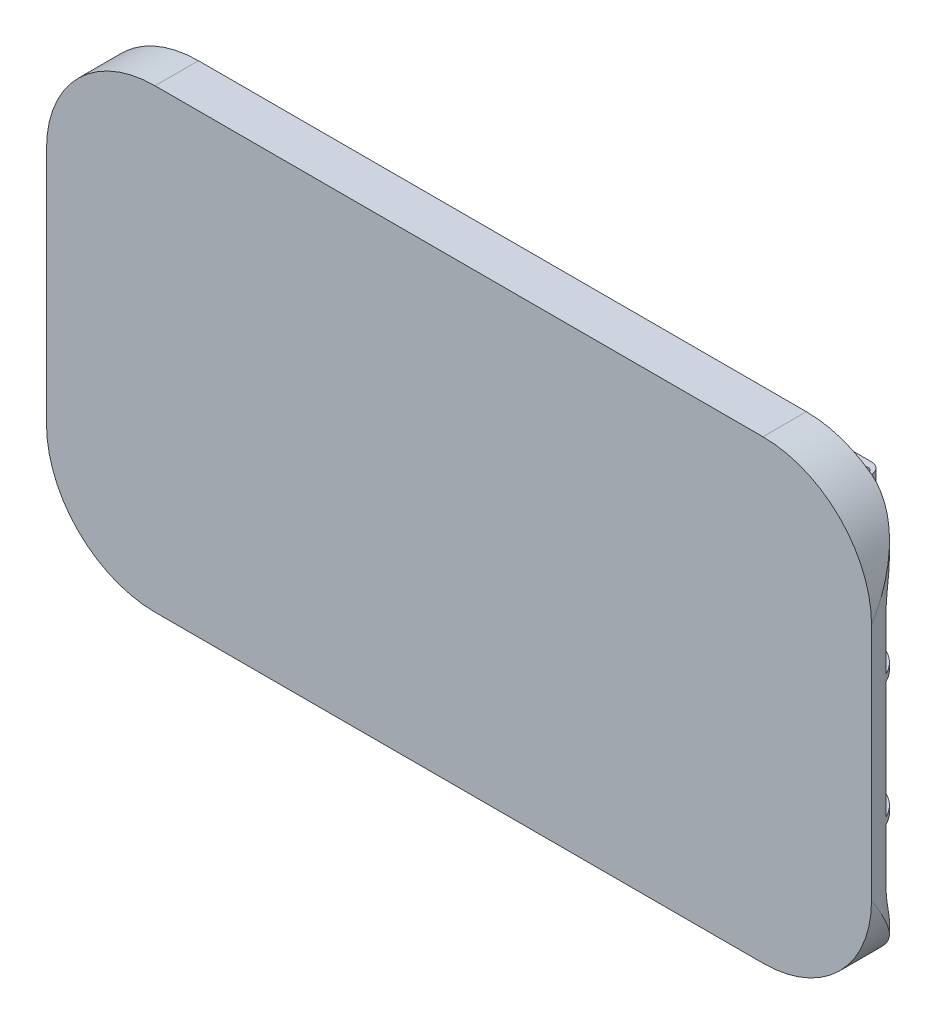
SolidWorks part; units mm, degrees
ref_plane "Front Plane" through (0, 0, 0) normal (0, 0, 1) x (1, 0, 0)
ref_plane "Top Plane" through (0, 0, 0) normal (0, 1, 0) x (1, 0, 0)
ref_plane "Right Plane" through (0, 0, 0) normal (1, 0, 0) x (0, 0, -1)
sketch "Sketch1" plane through (0, 0, 0) normal (0, 0, 1) x (1, 0, 0)
  line L1 (-190, 90) -> (190, 90)
  line L2 (-190, 90) -> (-190, -70)
  line L3 (-190, -70) -> (190, -70)
  line L4 (190, 90) -> (190, -70)
  dimension "D1" = 380
  dimension "D2" = 160
  dimension "D3" = 90
  dimension "D4" = 190
extrude "Boss-Extrude1" add sketch "Sketch1" along normal blind 3
sketch "Sketch3" plane through (0, -70, 0) normal (0, -1, 0) x (1, 0, 0)
  line L1 (-155, 3) -> (-130, 3)
  line L2 (-155, 3) -> (-155, -37)
  line L3 (-155, -37) -> (-130, -37)
  line L4 (-130, 3) -> (-130, -37)
  line L7 (-95, 0) -> (-95, -63.6731) construction
  line L8 (-60, 3) -> (-60, -37)
  line L9 (-35, -37) -> (-60, -37)
  line L10 (-35, 3) -> (-35, -37)
  line L11 (-35, 3) -> (-60, 3)
  line L12 (0, 0) -> (0, -25) construction
  line L13 (95, 0) -> (95, -63.6731) construction
  line L14 (35, 3) -> (60, 3)
  line L15 (35, 3) -> (35, -37)
  line L16 (35, -37) -> (60, -37)
  line L17 (60, 3) -> (60, -37)
  line L18 (130, 3) -> (130, -37)
  line L19 (155, -37) -> (130, -37)
  line L20 (155, 3) -> (155, -37)
  line L21 (155, 3) -> (130, 3)
  circle A0 centre (-151.5, -32) radius 2
  circle A1 centre (-133.5, -32) radius 2
  circle A2 centre (-56.5, -32) radius 2
  circle A3 centre (-38.5, -32) radius 2
  circle A4 centre (38.5, -32) radius 2
  circle A5 centre (56.5, -32) radius 2
  circle A6 centre (133.5, -32) radius 2
  circle A7 centre (151.5, -32) radius 2
  point P4 (0, 0)
  dimension "D4" = 35
  dimension "D8" = 35
  dimension "D3" = 35
  dimension "D1" = 25
  dimension "D2" = 40
  dimension "D9" = 35
extrude "Boss-Extrude2" add sketch "Sketch3" against normal blind 5
sketch "Sketch4" plane through (0, 90, 0) normal (0, 1, 0) x (1, 0, 0)
  line L4 (-155, -3) -> (-130, -3)
  line L5 (-130, -3) -> (-130, 37)
  line L6 (-130, 37) -> (-155, 37)
  line L7 (-155, 37) -> (-155, -3)
  line L8 (-155, -3) -> (-130, -3)
  line L9 (-130, -3) -> (-130, 37)
  line L10 (-130, 37) -> (-155, 37)
  line L11 (-155, 37) -> (-155, -3)
  line L12 (-60, 37) -> (-60, -3)
  line L13 (-35, 37) -> (-60, 37)
  line L14 (-35, -3) -> (-35, 37)
  line L15 (-60, -3) -> (-35, -3)
  line L16 (-60, 37) -> (-60, -3)
  line L17 (-35, 37) -> (-60, 37)
  line L18 (-35, -3) -> (-35, 37)
  line L19 (-60, -3) -> (-35, -3)
  line L20 (130, 37) -> (130, -3)
  line L21 (155, 37) -> (130, 37)
  line L22 (155, -3) -> (155, 37)
  line L23 (130, -3) -> (155, -3)
  line L24 (130, 37) -> (130, -3)
  line L25 (155, 37) -> (130, 37)
  line L26 (155, -3) -> (155, 37)
  line L27 (130, -3) -> (155, -3)
  line L28 (35, -3) -> (60, -3)
  line L29 (60, -3) -> (60, 37)
  line L30 (60, 37) -> (35, 37)
  line L31 (35, 37) -> (35, -3)
  line L32 (35, -3) -> (60, -3)
  line L33 (60, -3) -> (60, 37)
  line L34 (60, 37) -> (35, 37)
  line L35 (35, 37) -> (35, -3)
  circle A1 centre (-133.5, 32) radius 2
  circle A2 centre (-133.5, 32) radius 2
  circle A3 centre (-151.5, 32) radius 2
  circle A4 centre (-151.5, 32) radius 2
  circle A5 centre (56.5, 32) radius 2
  circle A6 centre (56.5, 32) radius 2
  circle A7 centre (38.5, 32) radius 2
  circle A8 centre (38.5, 32) radius 2
  circle A9 centre (-38.5, 32) radius 2
  circle A10 centre (-38.5, 32) radius 2
  circle A11 centre (-56.5, 32) radius 2
  circle A12 centre (-56.5, 32) radius 2
  circle A13 centre (151.5, 32) radius 2
  circle A14 centre (151.5, 32) radius 2
  circle A15 centre (133.5, 32) radius 2
  circle A16 centre (133.5, 32) radius 2
  dimension "D1" = 0
  dimension "D2" = 0
  dimension "D3" = 0
  dimension "D4" = 0
  dimension "D5" = 0
  dimension "D6" = 0
  dimension "D7" = 0
  dimension "D8" = 0
  dimension "D9" = 0
  dimension "D10" = 0
  dimension "D11" = 0
  dimension "D12" = 0
extrude "Boss-Extrude3" add sketch "Sketch4" against normal blind 5
fillet "Fillet1" radius 5 32 edges at (155, 87.5, 0) (130, 87.5, 0) (60, 87.5, 0) (35, 87.5, 0) (-60, 87.5, 0) (-35, 87.5, 0) (-130, 87.5, 0) (-155, 87.5, 0) (-155, -67.5, 0) (-130, -67.5, 0) (-35, -67.5, 0) (-60, -67.5, 0) (35, -67.5, 0) (60, -67.5, 0) (130, -67.5, 0) (155, -67.5, 0) (155, -67.5, -37) (130, -67.5, -37) (60, -67.5, -37) (35, -67.5, -37) (-35, -67.5, -37) (-60, -67.5, -37) (-130, -67.5, -37) (-155, -67.5, -37) (-155, 87.5, -37) (-130, 87.5, -37) (-35, 87.5, -37) (-60, 87.5, -37) (60, 87.5, -37) (35, 87.5, -37) (130, 87.5, -37) (155, 87.5, -37)
sketch "Sketch5" plane through (0, 0, 0) normal (0, 0, -1) x (-1, 0, 0)
  line L0 (142.5, -70) -> (142.5, 90) construction
  line L3 (47.5, -70) -> (47.5, 90) construction
  line L4 (55, -70) -> (40, -70) construction
  line L5 (40, 90) -> (55, 90) construction
  line L6 (150, -65) -> (135, -65) construction
  line L7 (144.5, -65) -> (140.5, -65)
  line L8 (144.5, -65) -> (144.5, 85)
  line L9 (144.5, 85) -> (140.5, 85)
  line L10 (140.5, -65) -> (140.5, 85)
  line L12 (135, 85) -> (150, 85) construction
  line L15 (150, -70) -> (135, -70) construction
  line L16 (135, 90) -> (150, 90) construction
  line L17 (55, -65) -> (40, -65) construction
  line L18 (49.5, -65) -> (45.5, -65)
  line L19 (49.5, -65) -> (49.5, 85)
  line L20 (49.5, 85) -> (45.5, 85)
  line L21 (45.5, -65) -> (45.5, 85)
  line L22 (40, 85) -> (55, 85) construction
  line L23 (0, 90) -> (0, -70) construction
  line L24 (-30, 90) -> (30, 90) construction
  line L25 (30, -70) -> (-30, -70) construction
  line L26 (-47.5, -70) -> (-47.5, 90) construction
  line L27 (-142.5, -70) -> (-142.5, 90) construction
  line L28 (-45.5, -65) -> (-45.5, 85)
  line L29 (-49.5, 85) -> (-45.5, 85)
  line L30 (-49.5, -65) -> (-49.5, 85)
  line L31 (-49.5, -65) -> (-45.5, -65)
  line L32 (-140.5, -65) -> (-140.5, 85)
  line L33 (-144.5, 85) -> (-140.5, 85)
  line L34 (-144.5, -65) -> (-144.5, 85)
  line L35 (-144.5, -65) -> (-140.5, -65)
  dimension "D1" = 0
  dimension "D2" = 2
  dimension "D3" = 2
  dimension "D4" = 2
  dimension "D5" = 2
extrude "Boss-Extrude4" add sketch "Sketch5" along normal blind 15
chamfer "Chamfer1" distance 7 angle 45 8 edges at (142.5, -65, -15) (47.5, -65, -15) (-47.5, -65, -15) (-142.5, -65, -15) (-142.5, 85, -15) (-47.5, 85, -15) (47.5, 85, -15) (142.5, 85, -15)
sketch "Sketch6" plane through (0, 0, 0) normal (0, 0, -1) x (-1, 0, 0)
  line L0 (190, 90) -> (190, -70) construction
  line L1 (190, -20) -> (-190, -20)
  line L2 (190, -20) -> (190, -17)
  line L3 (190, -17) -> (-190, -17)
  line L4 (-190, -20) -> (-190, -17)
  line L5 (-190, -70) -> (-190, 90) construction
  line L6 (160, 90) -> (190, 90) construction
  line L7 (-190, 37) -> (190, 37)
  line L8 (-190, 37) -> (-190, 40)
  line L9 (-190, 40) -> (190, 40)
  line L10 (190, 37) -> (190, 40)
  line L11 (190, -70) -> (160, -70) construction
  dimension "D1" = 3
  dimension "D2" = 50
  dimension "D3" = 3
  dimension "D4" = 50
extrude "Boss-Extrude5" add sketch "Sketch6" along normal blind 15
sketch "Sketch7" plane through (0, 0, 3) normal (0, 0, 1) x (1, 0, 0)
  line L0 (190, 90) -> (-190, 90) construction
  line L1 (-190, 115) -> (190, 115)
  line L2 (-190, 115) -> (-190, -95)
  line L3 (-190, -95) -> (190, -95)
  line L4 (190, 115) -> (190, -95)
  line L5 (-190, -70) -> (190, -70) construction
  point P10 (0, 0)
  dimension "D1" = 25
  dimension "D2" = 25
extrude "Boss-Extrude6" add sketch "Sketch7" against normal blind 3
fillet "Fillet3" radius 50 4 edges at (190, -95, 1.5) (190, 115, 1.5) (-190, 115, 1.5) (-190, -95, 1.5)
sketch "Sketch8" plane through (0, 0, 3) normal (0, 0, 1) x (1, 0, 0)
  line L0 (-140, -93) -> (140, -93)
  line L1 (188, -45) -> (188, 65)
  line L2 (140, 113) -> (-140, 113)
  line L3 (-188, 65) -> (-188, -45)
  line L4 (-140, -95) -> (140, -95)
  line L5 (190, -45) -> (190, 65)
  line L6 (140, 115) -> (-140, 115)
  line L7 (-190, 65) -> (-190, -45)
  line L8 (-140, -95) -> (140, -95)
  line L9 (190, -45) -> (190, 65)
  line L10 (140, 115) -> (-140, 115)
  line L11 (-190, 65) -> (-190, -45)
  arc A0 (140, -93) -> (188, -45) centre (140, -45) ccw
  arc A1 (188, 65) -> (140, 113) centre (140, 65) ccw
  arc A2 (-140, 113) -> (-188, 65) centre (-140, 65) ccw
  arc A3 (-188, -45) -> (-140, -93) centre (-140, -45) ccw
  arc A4 (140, -95) -> (190, -45) centre (140, -45) ccw
  arc A5 (190, 65) -> (140, 115) centre (140, 65) ccw
  arc A6 (-140, 115) -> (-190, 65) centre (-140, 65) ccw
  arc A7 (-190, -45) -> (-140, -95) centre (-140, -45) ccw
  arc A8 (140, -95) -> (190, -45) centre (140, -45) ccw
  arc A9 (190, 65) -> (140, 115) centre (140, 65) ccw
  arc A10 (-140, 115) -> (-190, 65) centre (-140, 65) ccw
  arc A11 (-190, -45) -> (-140, -95) centre (-140, -45) ccw
  dimension "D1" = 0
  dimension "D2" = 2
extrude "Boss-Extrude7" add sketch "Sketch8" against normal blind 20
sketch "Sketch9" plane through (0, -95, 0) normal (0, -1, 0) x (-1, 0, 0)
  line L0 (190, -3) -> (190, 17)
  line L1 (190, 17) -> (170, 17)
  line L2 (190, 17) -> (140, 17) construction
  line L3 (0, -3) -> (0, 28.5247) construction
  line L4 (140, -3) -> (-140, -3) construction
  line L5 (-190, 17) -> (-170, 17)
  line L6 (-190, -3) -> (-190, 17)
  arc A0 (190, -3) -> (170, 17) centre (170, -3) ccw
  arc A1 (-190, -3) -> (-170, 17) centre (-170, -3) cw
  dimension "D1" = 20
extrude "Cut-Extrude1" cut sketch "Sketch9" against normal through all
sketch "Sketch10" plane through (0, -20, 0) normal (0, -1, 0) x (1, 0, 0)
  line L1 (-170, -17) -> (-170, -15)
  line L2 (-188, -5.7178) -> (-188, 0) construction
  line L3 (-188, -5.7178) -> (-188, 0)
  line L4 (-186.2, -4.846) -> (-186.2, 0)
  line L5 (-144.5, 0) -> (-188, 0) construction
  line L6 (-186.2, 0) -> (-188, 0)
  arc A0 (-188, -5.7178) -> (-170, -17) centre (-170, 3) ccw construction
  arc A1 (-188, -5.7178) -> (-170, -17) centre (-170, 3) ccw
  arc A2 (-186.2, -4.846) -> (-170, -15) centre (-170, 3) ccw
  dimension "D1" = 2
extrude "Boss-Extrude10" add sketch "Sketch10" along normal up to surface and the other way up to surface
